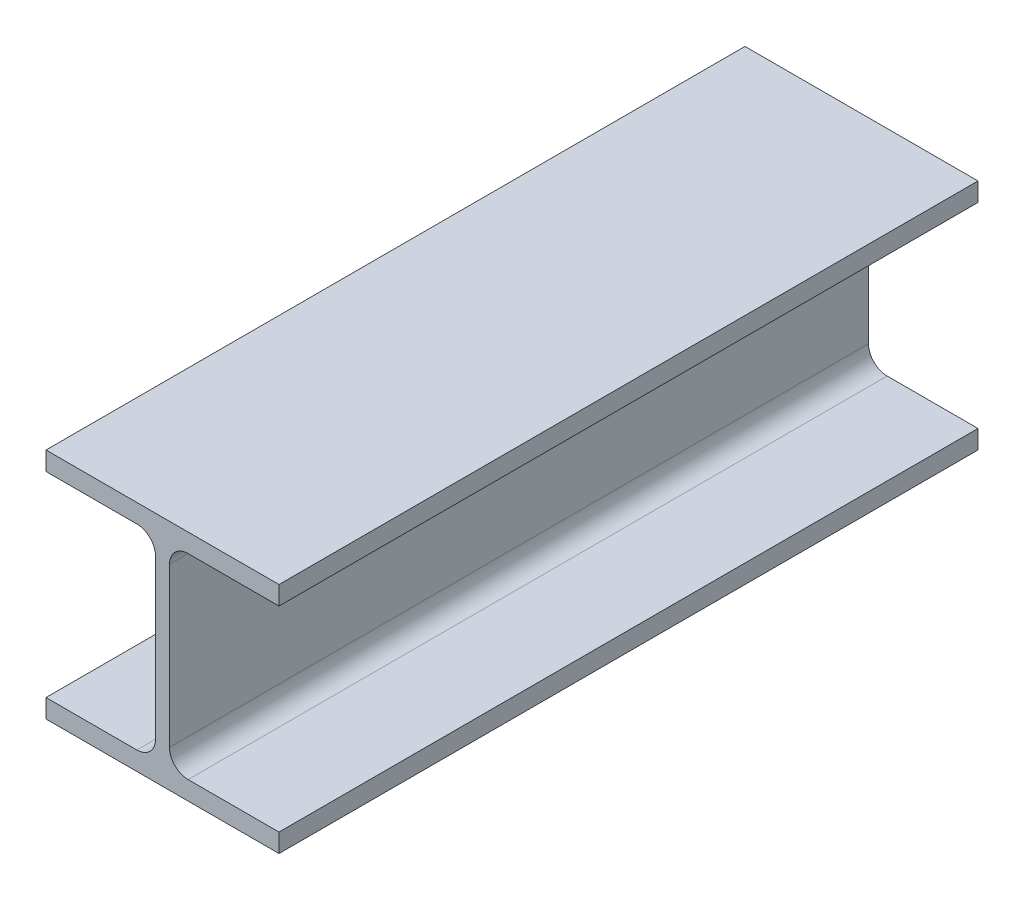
SolidWorks part; units mm, degrees
ref_plane "前视基准面" through (0, 0, 0) normal (0, 0, 1) x (1, 0, 0)
ref_plane "上视基准面" through (0, 0, 0) normal (0, 1, 0) x (1, 0, 0)
ref_plane "右视基准面" through (0, 0, 0) normal (1, 0, 0) x (0, 0, -1)
sketch "草图1" plane through (0, 0, 0) normal (0, 0, 1) x (1, 0, 0)
  line L0 (0, -50) -> (0, 50) construction
  line L1 (50, -50) -> (-50, -50)
  line L2 (-50, -50) -> (-50, -42)
  line L3 (-50, -42) -> (-11, -42)
  line L4 (-3, -34) -> (-3, 34)
  line L5 (-11, 42) -> (-50, 42)
  line L6 (-50, 42) -> (-50, 50)
  line L7 (-50, 50) -> (50, 50)
  line L8 (-36.8328, 59.0364) -> (63.1672, 59.0364) construction
  line L9 (-36.8328, 53.5317) -> (-30.8328, 53.5317) construction
  line L10 (50, 42) -> (50, 50)
  line L11 (11, 42) -> (50, 42)
  line L12 (3, -34) -> (3, 34)
  line L13 (50, -42) -> (11, -42)
  line L14 (50, -50) -> (50, -42)
  line L15 (0, 50) -> (0, 0) construction
  arc A0 (11, 42) -> (3, 34) centre (11, 34) ccw
  arc A1 (-11, -42) -> (-3, -34) centre (-11, -34) ccw
  arc A2 (-11, 42) -> (-3, 34) centre (-11, 34) cw
  arc A3 (11, -42) -> (3, -34) centre (11, -34) cw
  dimension "r" = 8
  dimension "D1" = 50
  dimension "B" = 100
  dimension "D2" = 3
  dimension "H" = 100
  dimension "t1" = 6
  dimension "D3" = 8
  dimension "t2" = 8
  dimension "D4" = 50
extrude "拉伸1" add sketch "草图1" along normal blind 300
sketch "草图2" plane through (0, 0, 0) normal (0, 1, 0) x (1, 0, 0)
  line L0 (0, 0) -> (0, -300)
  dimension "D1" = 300
equation "\"D1@草图1\" = \"B@草图1\" / 2"
equation "\"D2@草图1\" = \"t1@草图1\" / 2"
equation "\"D3@草图1\" = \"t2@草图1\""
equation "\"D4@草图1\" = \"H@草图1\" / 2"
equation "\"D1@草图2\" = \"D1@拉伸1\""
